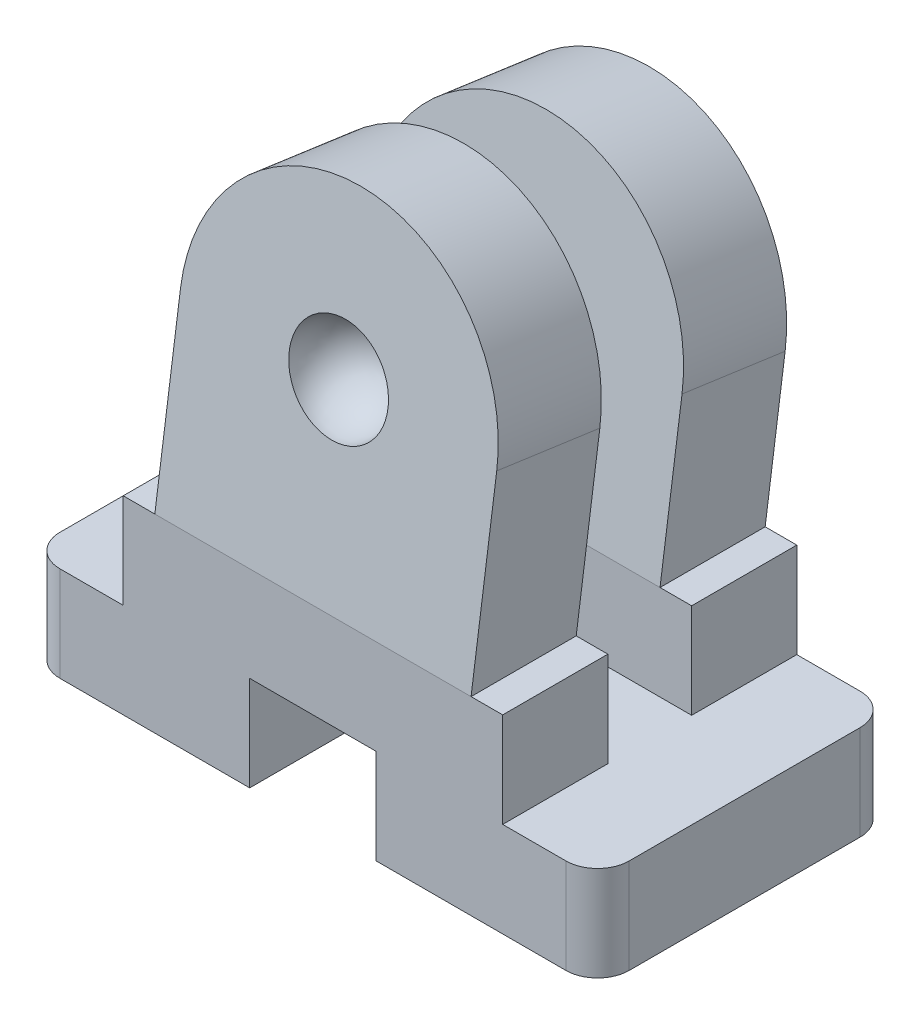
SolidWorks part; units mm, degrees
other "<b2>-<Corner Allowances>"
ref_plane "Front Plane" through (0, 0, 0) normal (0, 0, 1) x (1, 0, 0)
ref_plane "Top Plane" through (0, 0, 0) normal (0, 1, 0) x (1, 0, 0)
ref_plane "Right Plane" through (0, 0, 0) normal (1, 0, 0) x (0, 0, -1)
inserted part "b2"
sketch "Sketch1" plane through (0, -0.0664, -0.4724) normal (0, 0.1392, 0.9903) x (1, 0, 0)
  circle A0 centre (0, 11.126) radius 1.5625
extrude "Boss-Extrude1" add sketch "Sketch1" against normal offset from surface (1.7301 mm away) 1.5625
sketch "Sketch2" plane through (0, 0.2988, 2.1262) normal (0, -0.1392, -0.9903) x (-1, 0, 0)
  circle A0 centre (0, 11.126) radius 1.5625
extrude "Boss-Extrude2" add sketch "Sketch2" against normal offset from surface (1.7301 mm away) 1.5625
fillet "Fillet1" radius 1.5625 2 edges at (0, 9.1633, -3.5167) (0, 13.1046, 2.0737)
